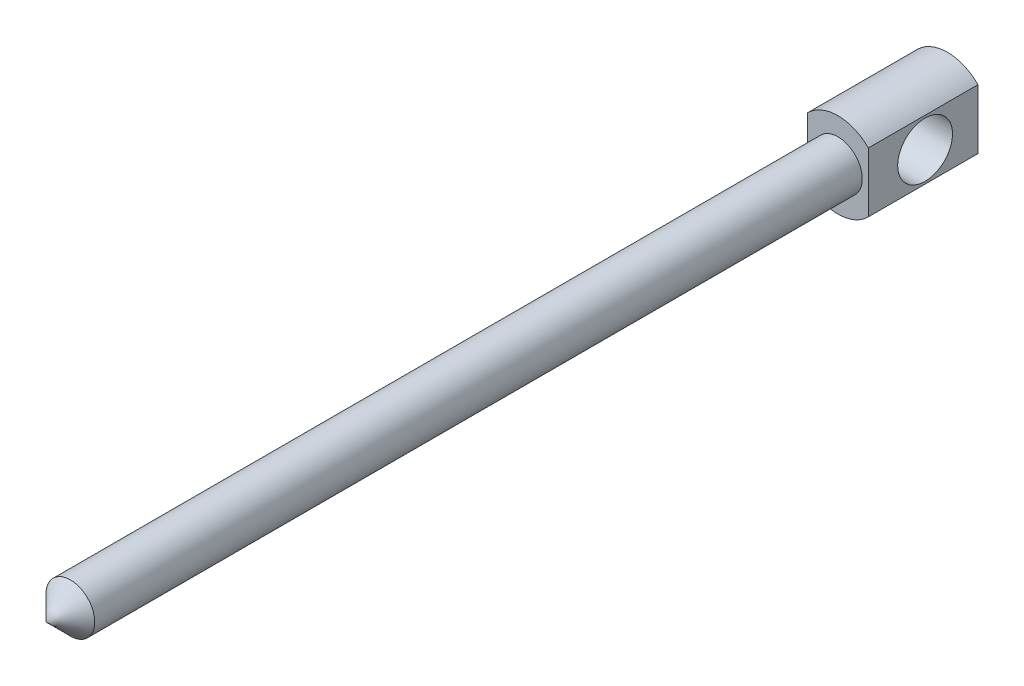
SolidWorks part; units mm, degrees
ref_plane "Plan de face" through (0, 0, 0) normal (0, 0, 1) x (1, 0, 0)
ref_plane "Plan de dessus" through (0, 0, 0) normal (0, 1, 0) x (1, 0, 0)
ref_plane "Plan de droite" through (0, 0, 0) normal (1, 0, 0) x (0, 0, -1)
sketch "Esquisse1" plane through (0, 0, 0) normal (0, 0, 1) x (1, 0, 0)
  circle A0 centre (0, 0) radius 2
  dimension "D1" = 4
extrude "Extrusion1" add sketch "Esquisse1" along normal blind 65
chamfer "Chanfrein1" distance 2 angle 45 1 edges at (2, 0, 65)
sketch "Esquisse2" plane through (0, 0, 0) normal (0, 0, -1) x (-1, 0, 0)
  circle A0 centre (0, 0) radius 3.5
  dimension "D1" = 7
extrude "Extrusion2" add sketch "Esquisse2" along normal blind 9
sketch "Esquisse3" plane through (0, 0, 0) normal (0, 1, 0) x (1, 0, 0)
  line L2 (-4.3636, 9.721) -> (-2.5, 9.721)
  line L3 (-4.3636, 9.721) -> (-4.3636, -1.1941)
  line L4 (-4.3636, -1.1941) -> (-2.5, -1.1941)
  line L5 (-2.5, 9.721) -> (-2.5, -1.1941)
  line L6 (2.5, 10.6084) -> (4.896, 10.6084)
  line L7 (2.5, 10.6084) -> (2.5, -1.1941)
  line L8 (2.5, -1.1941) -> (4.896, -1.1941)
  line L9 (4.896, 10.6084) -> (4.896, -1.1941)
  dimension "D1" = 5
  dimension "D2" = 2.5
extrude "Enlèv. mat.-Extru.1" cut sketch "Esquisse3" against normal through all and the other way through all
sketch "Esquisse4" plane through (-2.5, 0, 0) normal (-1, 0, 0) x (0, 0, 1)
  circle A0 centre (-4.6574, 0) radius 2.25
  dimension "D1" = 4.5
extrude "Enlèv. mat.-Extru.2" cut sketch "Esquisse4" against normal through all
